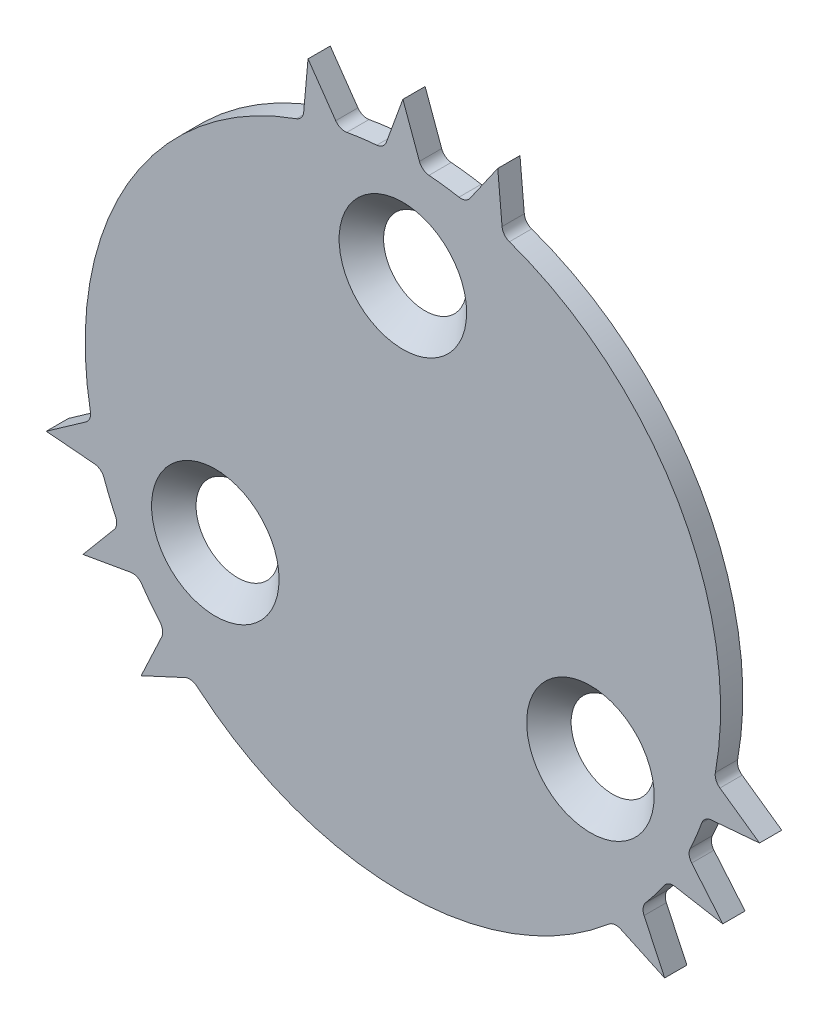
SolidWorks part; units mm, degrees
ref_plane "Ebene vorne" through (0, 0, 0) normal (0, 0, 1) x (1, 0, 0)
ref_plane "Ebene oben" through (0, 0, 0) normal (0, 1, 0) x (1, 0, 0)
ref_plane "Ebene rechts" through (0, 0, 0) normal (1, 0, 0) x (0, 0, -1)
sketch "Skizze1" plane through (0, 0, 0) normal (0, 0, 1) x (1, 0, 0)
  circle A0 centre (0, 0) radius 28.58
  dimension "D1" = 57.16
extrude "Linear austragen1" add sketch "Skizze1" along normal blind 2
sketch "Skizze2" plane through (0, 0, 2) normal (0, 0, 1) x (1, 0, 0)
  line L0 (-8.5333, 32.1157) -> (-8.9219, 27.7785)
  line L1 (-8.5333, 32.1157) -> (0, 0) construction
  line L2 (-6.0431, 28.5434) -> (-8.5333, 32.1157)
  line L3 (0, 0) -> (0, 33.7739) construction
  circle A0 centre (0, 0) radius 28.58 construction
  arc A1 (-5.0462, 28.131) -> (-9.5826, 26.9256) centre (0, 0) ccw
  arc A2 (-8.9219, 27.7785) -> (-9.5826, 26.9256) centre (-9.9179, 27.8677) cw
  arc A3 (-6.0431, 28.5434) -> (-5.0462, 28.131) centre (-5.2228, 29.1153) ccw
  dimension "D2" = 1
  dimension "D1" = 40
  dimension "D3" = 4.65
  dimension "D4" = 14.88
extrude "Linear austragen2" add sketch "Skizze2" against normal through all
pattern_circular "Kreismuster1" count 3 every 14.88 about axis through (0, 0, 0) along (0, 0, 1) of "Linear austragen2"
hole_wizard "Formsenkung für M5 Senkschraube mit Innensechskant5" positions "Skizze4" profile "Skizze5" countersink size "M5" standard "DIN"
sketch "Skizze4" plane through (0, 0, 2) normal (0, 0, 1) x (1, 0, 0)
  line L0 (0, -1.1) -> (0, 1.1) construction
  point P0 (0, 19.48)
  dimension "D1" = 13.75
sketch "Skizze5" plane through (0, 19.48, 2) normal (1, 0, 0) x (0, -1, 0)
  line L0 (0, 0) -> (0, 2)
  line L1 (0, 2) -> (2.65, 2)
  line L2 (2.65, 2) -> (2.65, 3.085)
  line L3 (2.65, 3.085) -> (5.735, 0)
  line L5 (5.735, 0) -> (0, 0)
  line L6 (-2.65, 3.085) -> (-5.735, 0) construction
  line L11 (0, -6.35) -> (0, 107.95) construction
  dimension "Bohrerdurchmesser" = 5.3
  dimension "Bohrungstiefe" = 2
  dimension "Senkdurchmesser (Oben)" = 11.47
  dimension "Senkwinkel (Oben)" = 90
pattern_circular "Kreismuster2" count 3 over 360 about axis through (0, 0, 0) along (0, 0, 1) of "Formsenkung für M5 Senkschraube mit Innensechskant5", "Kreismuster1", "Linear austragen2"
